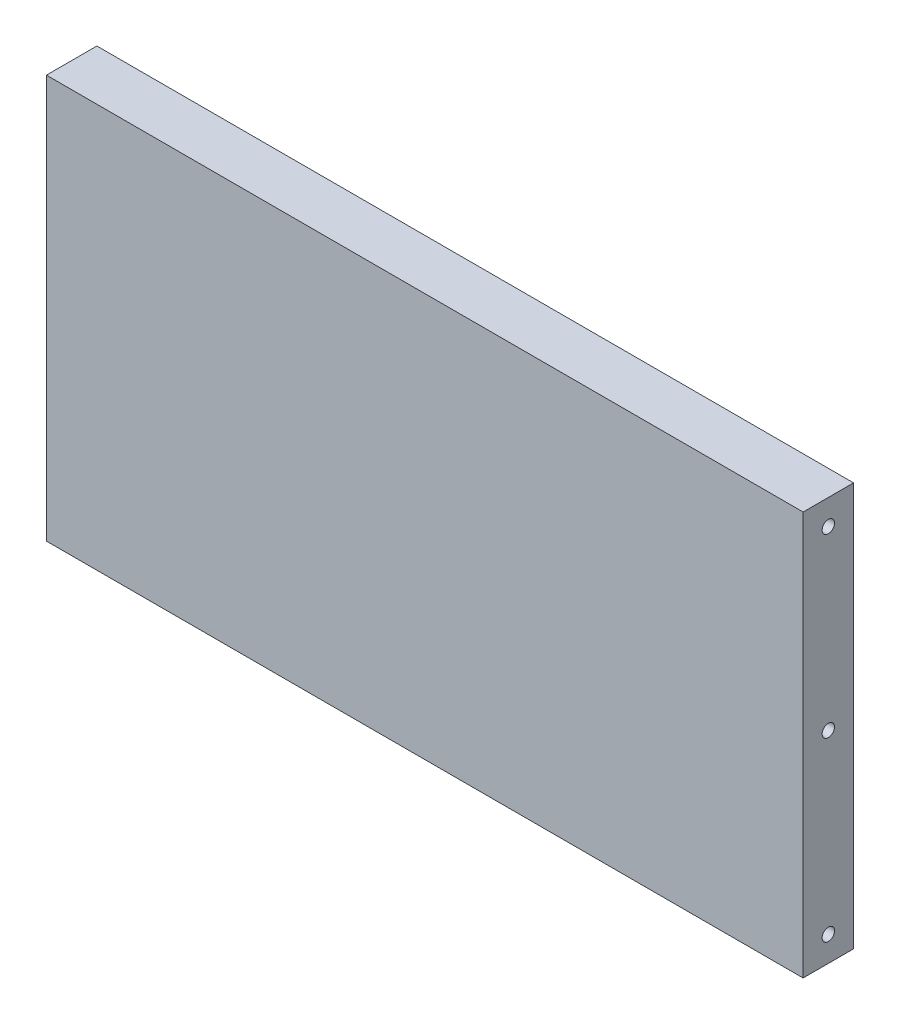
SolidWorks part; units mm, degrees
ref_plane "Ebene vorne" through (0, 0, 0) normal (0, 0, 1) x (1, 0, 0)
ref_plane "Ebene oben" through (0, 0, 0) normal (0, 1, 0) x (1, 0, 0)
ref_plane "Ebene rechts" through (0, 0, 0) normal (1, 0, 0) x (0, 0, -1)
sketch "Skizze1" plane through (0, 0, 0) normal (0, 0, 1) x (1, 0, 0)
  line L1 (-65.5556, 65.2273) -> (84.4444, 65.2273)
  line L2 (-65.5556, 65.2273) -> (-65.5556, -14.7727)
  line L3 (-65.5556, -14.7727) -> (84.4444, -14.7727)
  line L4 (84.4444, 65.2273) -> (84.4444, -14.7727)
  dimension "D1" = 150
  dimension "D2" = 80
extrude "Aufsatz-Linear austragen1" add sketch "Skizze1" along normal blind 10
sketch "Skizze2" plane through (-65.5556, 0, 0) normal (-1, 0, 0) x (0, 0, 1)
  line L0 (5, 60.2273) -> (5, -9.7727) construction
  line L1 (10, 65.2273) -> (0, 65.2273) construction
  line L2 (10, -14.7727) -> (0, -14.7727) construction
  line L3 (0, 65.2273) -> (0, -14.7727) construction
  circle A0 centre (5, 60.2273) radius 1.23
  circle A1 centre (5, 25.2273) radius 1.23
  circle A2 centre (5, -9.7727) radius 1.23
  dimension "D4" = 2.46
  dimension "D1" = 5
  dimension "D2" = 5
  dimension "D3" = 5
extrude "Schnitt-Linear austragen1" cut sketch "Skizze2" against normal blind 5
sketch "Skizze3" plane through (84.4444, 0, 0) normal (1, 0, 0) x (0, 0, -1)
  line L0 (-5, 60.2273) -> (-5, -9.7727) construction
  line L1 (-10, -14.7727) -> (-10, 65.2273) construction
  line L2 (-10, 65.2273) -> (0, 65.2273) construction
  line L3 (-10, -14.7727) -> (0, -14.7727) construction
  circle A0 centre (-5, 60.2273) radius 1.23
  circle A1 centre (-5, 25.2273) radius 1.23
  circle A2 centre (-5, -9.7727) radius 1.23
  dimension "D1" = 2.46
  dimension "D2" = 5
  dimension "D3" = 5
  dimension "D4" = 5
extrude "Schnitt-Linear austragen2" cut sketch "Skizze3" against normal blind 5
